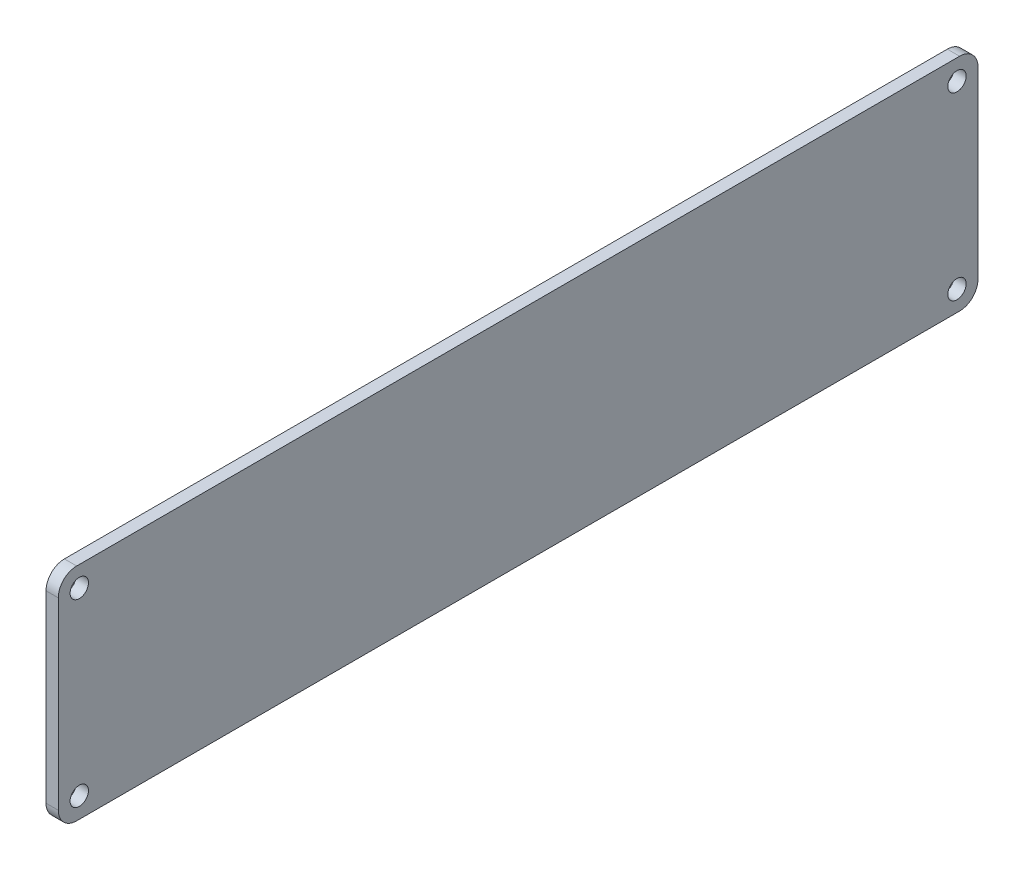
SolidWorks part; units mm, degrees
ref_plane "Front Plane" through (0, 0, 0) normal (0, 0, 1) x (1, 0, 0)
ref_plane "Top Plane" through (0, 0, 0) normal (0, 1, 0) x (1, 0, 0)
ref_plane "Right Plane" through (0, 0, 0) normal (1, 0, 0) x (0, 0, -1)
sketch "Sketch1" plane through (0, 0, 0) normal (1, 0, 0) x (0, 0, -1)
  line L1 (-75, 18) -> (75, 18)
  line L2 (-75, 18) -> (-75, -18)
  line L3 (-75, -18) -> (75, -18)
  line L4 (75, 18) -> (75, -18)
  line L5 (-75, 18) -> (75, -18) construction
  line L6 (-75, -18) -> (75, 18) construction
  point P0 (0, 0)
  dimension "D1" = 150
  dimension "D2" = 36
extrude "Boss-Extrude1" add sketch "Sketch1" along normal blind 2
sketch "Sketch2" plane through (2, 0, 0) normal (1, 0, 0) x (0, 0, -1)
  line L0 (0, 0) -> (0, 31.6968) construction
  line L1 (0, 0) -> (19.842, 0) construction
  circle A0 centre (-71.5704, 14.6789) radius 1.5
  circle A1 centre (71.5704, 14.6789) radius 1.5
  circle A2 centre (71.5704, -14.6789) radius 1.5
  circle A3 centre (-71.5704, -14.6789) radius 1.5
  dimension "D1" = 3
extrude "Cut-Extrude1" cut sketch "Sketch2" against normal blind 12
fillet "Fillet1" radius 3 4 edges at (1, -18, -75) (1, 18, -75) (1, -18, 75) (1, 18, 75)
